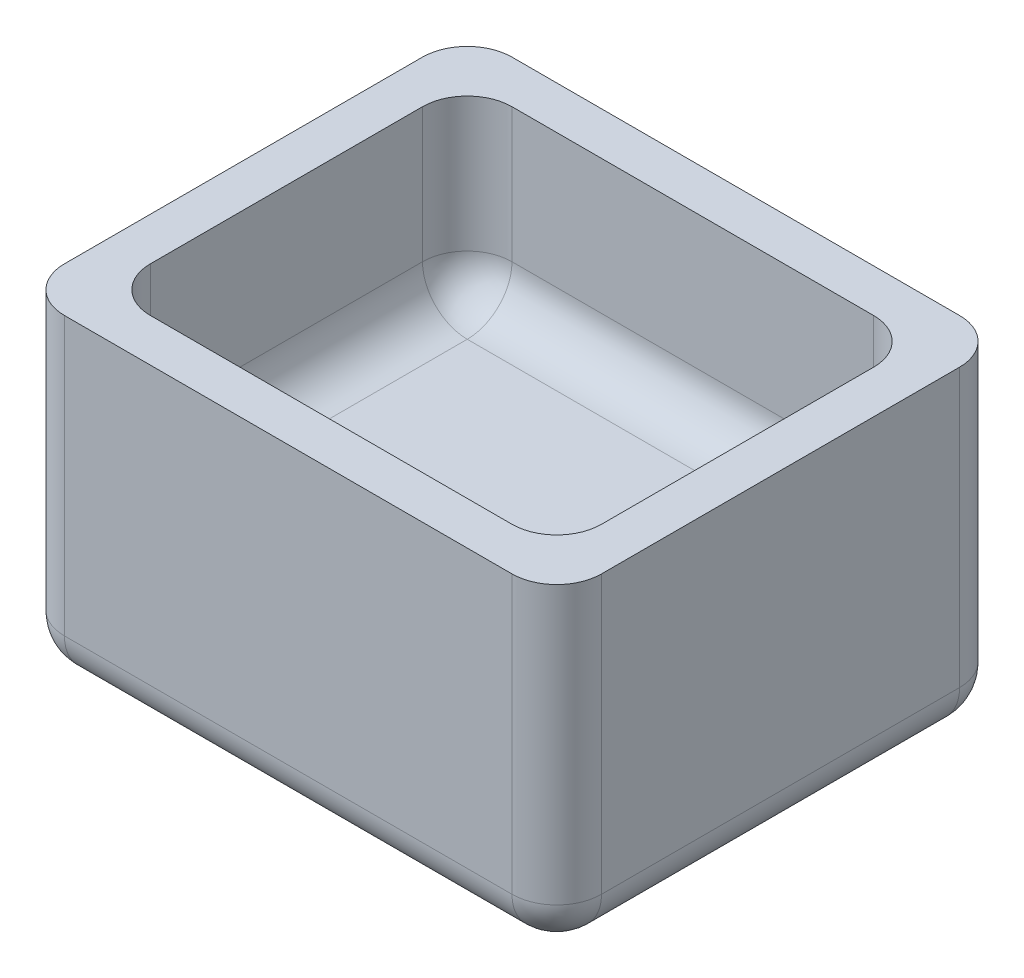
SolidWorks part; units mm, degrees
ref_plane "Ebene vorne" through (0, 0, 0) normal (0, 0, 1) x (1, 0, 0)
ref_plane "Ebene oben" through (0, 0, 0) normal (0, 1, 0) x (1, 0, 0)
ref_plane "Ebene rechts" through (0, 0, 0) normal (1, 0, 0) x (0, 0, -1)
sketch "Skizze1" plane through (0, 0, 0) normal (0, 1, 0) x (1, 0, 0)
  line L1 (15, 12.5) -> (-15, 12.5)
  line L2 (15, 12.5) -> (15, -12.5)
  line L3 (15, -12.5) -> (-15, -12.5)
  line L4 (-15, 12.5) -> (-15, -12.5)
  line L5 (15, 12.5) -> (-15, -12.5) construction
  line L6 (15, -12.5) -> (-15, 12.5) construction
  dimension "D1" = 30
  dimension "D2" = 25
extrude "Aufsatz-Linear austragen1" add sketch "Skizze1" against normal blind 15 and the other way blind 3
sketch "Skizze2" plane through (0, 3, 0) normal (0, 1, 0) x (1, 0, 0)
  line L8 (-12.6, 10.1) -> (-12.6, -10.1)
  line L9 (-12.6, -10.1) -> (12.6, -10.1)
  line L10 (12.6, -10.1) -> (12.6, 10.1)
  line L11 (12.6, 10.1) -> (-12.6, 10.1)
  line L12 (-12.6, 10.1) -> (-12.6, -10.1)
  line L13 (-12.6, -10.1) -> (12.6, -10.1)
  line L14 (12.6, -10.1) -> (12.6, 10.1)
  line L15 (12.6, 10.1) -> (-12.6, 10.1)
  dimension "D1" = 2.4
extrude "Schnitt-Linear austragen1" cut sketch "Skizze2" against normal blind 10
fillet "Verrundung2" radius 2.5 8 edges at (12.6, -2, -10.1) (12.6, -2, 10.1) (-12.6, -2, 10.1) (-12.6, -2, -10.1) (-12.6, -7, 0) (0, -7, 10.1) (12.6, -7, 0) (0, -7, -10.1)
fillet "Verrundung4" radius 2.5 8 edges at (15, -15, 0) (0, -15, -12.5) (-15, -15, 0) (0, -15, 12.5) (15, -6, 12.5) (15, -6, -12.5) (-15, -6, 12.5) (-15, -6, -12.5)
